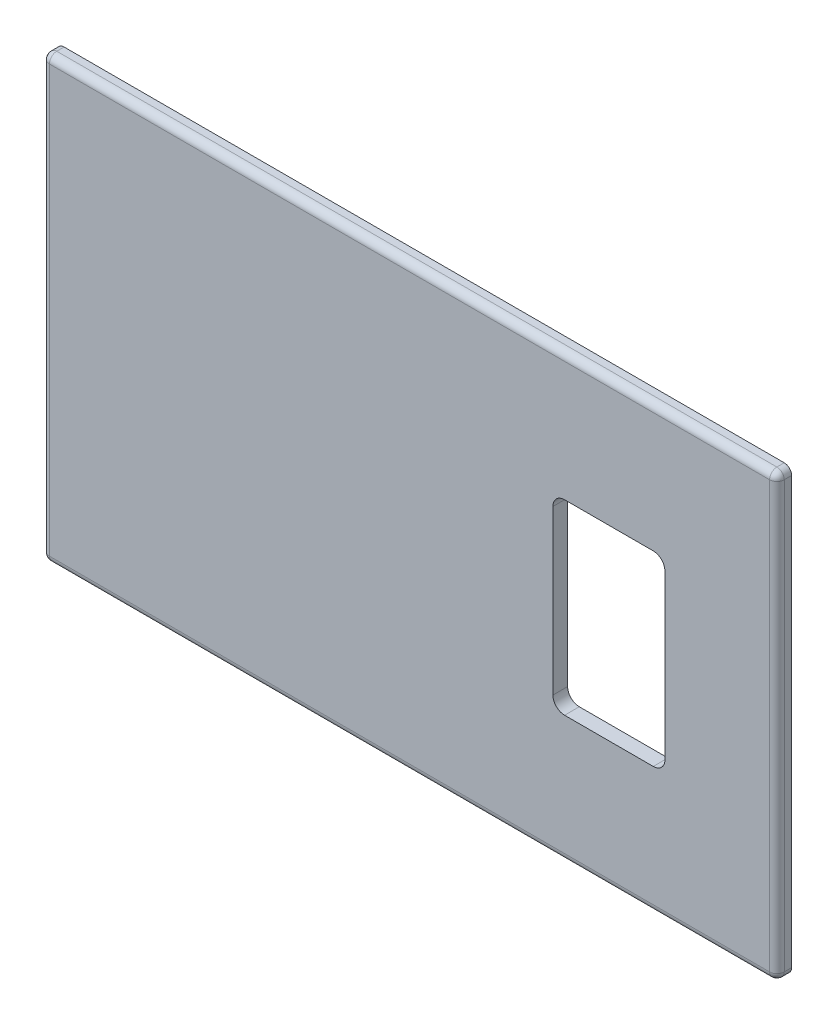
SolidWorks part; units mm, degrees
ref_plane "Front Plane" through (0, 0, 0) normal (0, 0, 1) x (1, 0, 0)
ref_plane "Top Plane" through (0, 0, 0) normal (0, 1, 0) x (1, 0, 0)
ref_plane "Right Plane" through (0, 0, 0) normal (1, 0, 0) x (0, 0, -1)
sketch "Sketch1" plane through (0, 0, 0) normal (0, 0, 1) x (1, 0, 0)
  line L1 (-50, -30) -> (50, -30)
  line L2 (-50, -30) -> (-50, 30)
  line L3 (-50, 30) -> (50, 30)
  line L4 (50, -30) -> (50, 30)
  line L5 (-50, -30) -> (50, 30) construction
  line L6 (-50, 30) -> (50, -30) construction
  point P0 (0, 0)
  dimension "D1" = 100
  dimension "D2" = 60
extrude "Boss-Extrude1" add sketch "Sketch1" along normal blind 2 contours L2 L3 L4 L1
fillet "Fillet1" radius 1 8 edges at (-50, 0, 2) (0, -30, 2) (50, 0, 2) (0, 30, 2) (50, 30, 1) (50, -30, 1) (-50, -30, 1) (-50, 30, 1)
sketch "Sketch2" plane through (0, 0, 2) normal (0, 0, 1) x (1, 0, 0)
  line L0 (27.14, 0) -> (0, 0) construction
  line L1 (34.76, 12.7) -> (19.52, 12.7)
  line L2 (34.76, 12.7) -> (34.76, -12.7)
  line L3 (34.76, -12.7) -> (19.52, -12.7)
  line L4 (19.52, 12.7) -> (19.52, -12.7)
  line L5 (34.76, 12.7) -> (19.52, -12.7) construction
  line L6 (34.76, -12.7) -> (19.52, 12.7) construction
  line L7 (50, -29) -> (50, 29) construction
  point P0 (27.14, 0)
  dimension "D1" = 25.4
  dimension "D2" = 15.24
  dimension "D4" = 15.24
extrude "Cut-Extrude1" cut sketch "Sketch2" against normal through all
fillet "Fillet2" radius 1.5875 4 edges at (19.52, 12.7, 1) (19.52, -12.7, 1) (34.76, -12.7, 1) (34.76, 12.7, 1)
